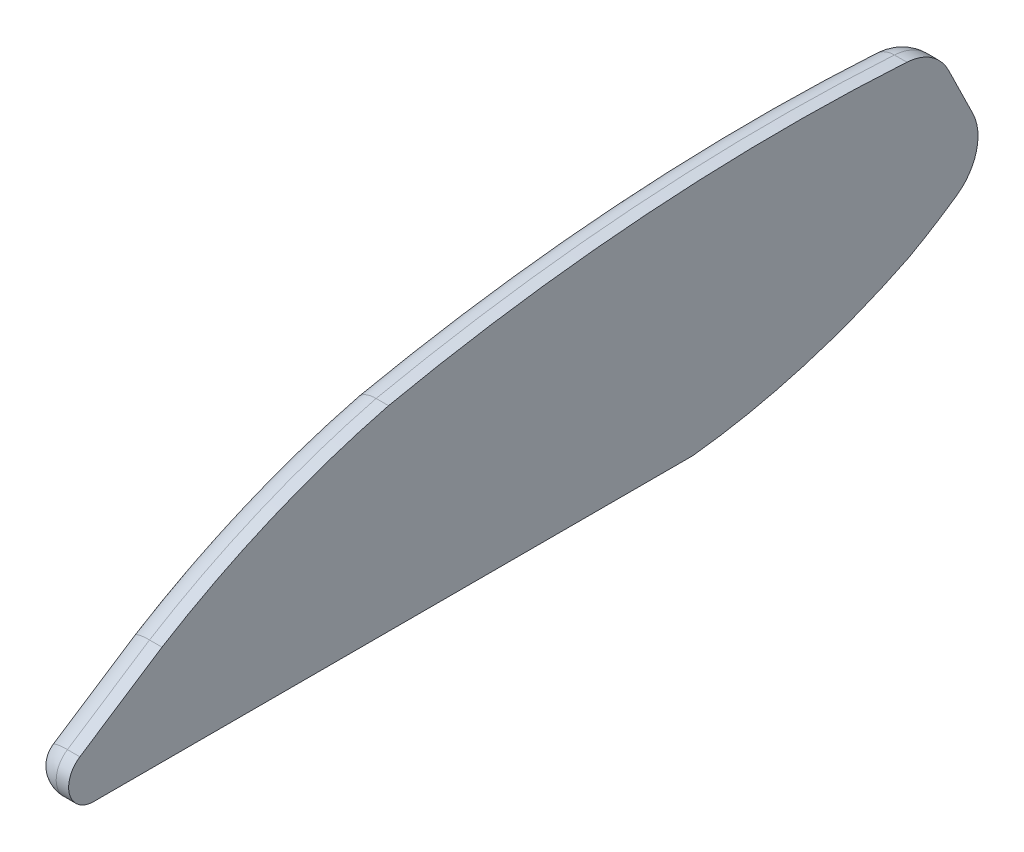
SolidWorks part; units mm, degrees
ref_plane "Alzado" through (0, 0, 0) normal (0, 0, 1) x (1, 0, 0)
ref_plane "Planta" through (0, 0, 0) normal (0, 1, 0) x (1, 0, 0)
ref_plane "Vista lateral" through (0, 0, 0) normal (1, 0, 0) x (0, 0, -1)
sketch "Croquis1" plane through (0, 0, 0) normal (1, 0, 0) x (0, 0, -1)
  line L0 (13448.7874, 5150.8637) -> (13481.7652, 5172.5029)
  line L1 (13454.2736, 5132.5029) -> (13695.0821, 5132.5029)
  line L2 (13797.6803, 5215.2328) -> (13807.4839, 5195.2188)
  arc A0 (13448.7874, 5150.8637) -> (13454.2736, 5132.5029) centre (13454.2736, 5142.5029) ccw
  arc A1 (13572.7711, 5211.0068) -> (13481.7652, 5172.5029) centre (13652.9813, 4894.6253) ccw
  arc A2 (13780.9479, 5226.397) -> (13572.7711, 5211.0068) centre (13733.4027, 4453.8679) ccw
  arc A3 (13797.6803, 5215.2328) -> (13780.9479, 5226.397) centre (13779.7193, 5206.4348) ccw
  arc A4 (13781.7959, 5158.0677) -> (13800.9788, 5170.0267) centre (13677.4696, 5346.7774) ccw
  arc A5 (13800.9788, 5170.0267) -> (13807.4839, 5195.2188) centre (13789.523, 5186.4208) ccw
  arc A6 (13695.0821, 5132.5029) -> (13781.7959, 5158.0677) centre (13665.8802, 5391.3988) ccw
extrude "Saliente-Extruir1" add sketch "Croquis1" along normal blind 15
fillet "Redondeo1" radius 10 10 edges at (0, 5132.5029, -13574.6778) (0, 5141.4955, -13739.5563) (0, 5163.7957, -13791.5442) (0, 5181.4204, -13808.8878) (0, 5205.2258, -13802.5821) (0, 5223.0715, -13790.8198) (0, 5225.7522, -13676.3383) (0, 5195.2188, -13525.8025) (0, 5161.6833, -13465.2763) (0, 5139.64, -13444.6921)
